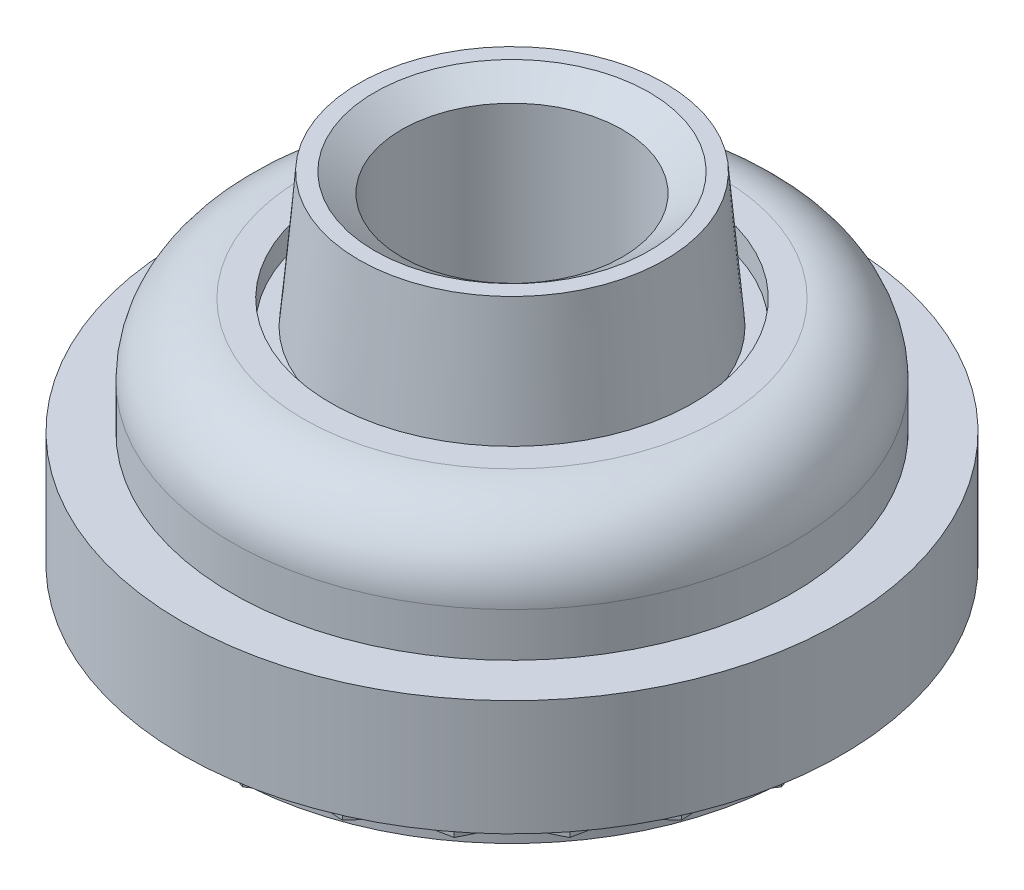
SolidWorks part; units mm, degrees
ref_plane "Plane1" through (0, 0, 0) normal (0, 0, 1) x (1, 0, 0)
ref_plane "Plane2" through (0, 0, 0) normal (0, 1, 0) x (1, 0, 0)
ref_plane "Plane3" through (0, 0, 0) normal (1, 0, 0) x (0, 0, -1)
sketch "BodySke" plane through (0, 0, 0) normal (0, 0, 1) x (1, 0, 0)
  line L0 (6.3049, 0) -> (7.62, 0)
  line L1 (7.62, 0) -> (7.62, 2.667)
  line L2 (3.5389, 7.874) -> (2.5527, 7.874)
  line L3 (2.5527, 7.874) -> (2.5527, -0.9652)
  line L4 (2.5527, -0.9652) -> (6.5278, -0.9652)
  line L5 (6.5278, -0.9652) -> (6.5278, -0.7722)
  line L6 (6.5278, -0.7722) -> (6.3049, -0.3861)
  line L7 (1.016, 1.27) -> (3.6522, 1.27) construction
  line L9 (0, 0) -> (0, 15.24) construction
  line L10 (6.3049, -0.3861) -> (6.3049, 0)
  line L11 (3.81, 4.7752) -> (4.191, 4.7752)
  line L12 (4.191, 4.7752) -> (4.191, 5.334)
  line L13 (4.191, 5.334) -> (4.826, 5.334)
  line L14 (7.62, 2.667) -> (6.477, 2.667)
  line L15 (6.477, 2.667) -> (6.477, 3.683)
  line L16 (3.81, 4.7752) -> (3.5389, 7.874)
  arc A0 (6.477, 3.683) -> (4.826, 5.334) centre (4.826, 3.683) ccw
  dimension "D1" = 60
  dimension "E_dia" = 15.24
  dimension "C_dia" = 13.0556
  dimension "A_ht" = 0.9652
  dimension "Thread_min" = 5.1054
  dimension "C_len" = 0.193
  dimension "Clinching_ht" = 0.3861
  dimension "Advance" = 1.27
  dimension "T2_ht" = 7.874
  dimension "Nose_dia" = 7.62
  dimension "Guide_dia" = 8.382
  dimension "Top_flat_wid" = 0.635
  dimension "T1_ht" = 5.334
  dimension "T2_nl_lim" = 4.7752
  dimension "D_dia" = 12.954
  dimension "Shoulder_ht" = 2.667
  dimension "Nose_ang" = 175
revolve "Body" add sketch "BodySke"
revolve "EndChamfer" cut sketch "EndChamferSke" angle 360 about L0
sketch "EndChamferSke" plane through (0, 0, 0) normal (0, 0, 1) x (1, 0, 0)
  line L0 (0, -2.54) -> (0, 7.62) construction
  line L1 (0, 0) -> (0, 15.24) construction
  line L2 (3.175, -1.2192) -> (3.175, -0.9627)
  line L3 (3.175, -0.9627) -> (2.5527, -0.5271)
  line L4 (2.5527, -0.5271) -> (2.5527, -1.2192)
  line L5 (2.5527, -1.2192) -> (3.175, -1.2192)
  line L6 (3.175, 7.874) -> (2.5527, 7.4384)
  line L8 (2.5527, 7.4384) -> (2.5527, 7.874)
  line L9 (3.175, 7.874) -> (2.5527, 7.874)
  line L10 (2.5527, 7.874) -> (-2.5527, 7.874) construction
  line L11 (-6.5278, -0.9652) -> (6.5278, -0.9652) construction
  dimension "D1" = 0.254
  dimension "Thread_nominal" = 6.35
  dimension "D2" = 34.99
  dimension "Thread_min" = 5.1054
  dimension "Inset" = 0.0025
sketch "CliRinSegSke" plane through (0, 0, 0) normal (0, -1, 0) x (1, 0, 0)
  line L0 (0, 0) -> (0, 7.62) construction
  line L1 (0.9449, 7.1771) -> (0, 6.858)
  line L2 (0, 6.858) -> (-0.9449, 7.1771)
  line L3 (-0.9449, 7.1771) -> (-0.9165, 6.9618)
  line L4 (-0.9165, 6.9618) -> (0, 6.6523)
  line L5 (0, 6.6523) -> (0.9165, 6.9618)
  line L6 (0.9165, 6.9618) -> (0.9449, 7.1771)
  circle A0 centre (0, 0) radius 7.239 construction
  circle A1 centre (0, 0) radius 6.858 construction
  circle A2 centre (0, 0) radius 6.6523 construction
  circle A3 centre (0, 0) radius 7.0218 construction
  circle A4 centre (0, 0) radius 6.5278 construction
  dimension "D2" = 14.0437
  dimension "D3" = 13.716
  dimension "D4" = 13.3045
  dimension "D1" = 14.478
  dimension "Angle" = 15
ref_plane "Plane4" through (0, -0.5486, 0) normal (0, 1, 0) x (-1, 0, 0)
sketch "ThdSchSke" plane through (0, 0, 0) normal (0, 0, 1) x (1, 0, 0)
  line L0 (0, -5.08) -> (0, 7.62) construction
  line L1 (0, 0) -> (0, 15.24) construction
  line L2 (0, -0.9627) -> (3.175, -0.9627) construction
  line L4 (3.175, -0.9627) -> (2.5527, -0.5269)
  line L6 (3.175, -0.9627) -> (2.5527, -1.3984)
  line L7 (2.5527, -0.5269) -> (2.5527, -1.3984)
  line L8 (3.175, -0.9627) -> (-3.175, -0.9627) construction
  dimension "Vee_angle" = 70
  dimension "Thread_nominal" = 6.35
  dimension "Thread_min" = 5.1054
revolve "ThreadSchematic" [suppressed] cut sketch "ThdSchSke" angle 360 about L0
pattern_linear "ThdSchPat" [suppressed]
extrude "ClinchingRingSegment" add sketch "CliRinSegSke" along normal blind 0.3861
pattern_circular "ClinchingRing" count 24 every 15 about axis through (0, 0, 0) along (0, 1, 0) of "ClinchingRingSegment"
sketch "SqrCutSke" plane through (0, -0.9652, 0) normal (0, -1, 0) x (1, 0, 0)
  line L0 (3.81, -3.556) -> (3.81, 3.556)
  line L1 (3.556, 3.81) -> (-3.556, 3.81)
  line L2 (-3.81, 3.556) -> (-3.81, -3.556)
  line L3 (-3.556, -3.81) -> (3.556, -3.81)
  line L4 (-3.556, -4.191) -> (3.556, -4.191)
  line L5 (-4.191, 3.556) -> (-4.191, -3.556)
  line L6 (3.556, 4.191) -> (-3.556, 4.191)
  line L7 (4.191, -3.556) -> (4.191, 3.556)
  circle A0 centre (0, 0) radius 3.81 construction
  circle A1 centre (0, 0) radius 3.81 construction
  circle A4 centre (0, 0) radius 5.3882 construction
  arc A6 (-3.81, 3.556) -> (-3.556, 3.81) centre (-3.556, 3.556) cw
  arc A7 (3.81, 3.556) -> (3.556, 3.81) centre (3.556, 3.556) ccw
  arc A8 (3.556, -3.81) -> (3.81, -3.556) centre (3.556, -3.556) ccw
  arc A9 (-3.81, -3.556) -> (-3.556, -3.81) centre (-3.556, -3.556) ccw
  arc A10 (-4.191, -3.556) -> (-3.556, -4.191) centre (-3.556, -3.556) ccw
  arc A11 (-4.191, 3.556) -> (-3.556, 4.191) centre (-3.556, 3.556) cw
  arc A12 (4.191, 3.556) -> (3.556, 4.191) centre (3.556, 3.556) ccw
  arc A13 (3.556, -4.191) -> (4.191, -3.556) centre (3.556, -3.556) ccw
  point P12 (-3.81, 3.81)
  point P15 (3.81, 3.81)
  point P18 (3.81, -3.81)
  point P21 (-3.81, -3.81)
  dimension "D1" = 0.254
  dimension "D2" = 0.381
extrude "SqrCut" cut sketch "SqrCutSke" against normal blind 0.9652
equation "' \"A_ht@BodySke\" = 0.038"
equation "' \"C_dia@BodySke\" = 0.514"
equation "' \"D_dia@BodySke\" = 0.51"
equation "' \"E_dia@BodySke\" = 0.6"
equation "' \"T1_ht@BodySke\" = 0.21"
equation "' \"T2_ht@BodySke\" = 0.31"
equation "' \"Advance@BodySke\" = 0.05"
equation "' \"Thread_min@BodySke\" = 0.201"
equation "' \"Thread_nominal@ThreadCosmetic\" = 0.25"
equation "' \"Nose_ang@BodySke\" = 175"
equation "' \"T2_ht@BodySke\" =  \"T1_ht@BodySke\" * 0.9 ' make NL"
equation "\"Nose_dia@BodySke\" = \"Thread_nominal@ThreadCosmetic\" * 1.2"
equation "\"Top_flat_wid@BodySke\" = \"Thread_nominal@ThreadCosmetic\" * 0.1"
equation "\"Guide_dia@BodySke\" = \"Nose_dia@BodySke\" + 0.03"
equation "\"T2_nl_lim@BodySke\" = \"T1_ht@BodySke\" * 0.9 - 0.001"
equation "\"Shoulder_ht@BodySke\" = \"T1_ht@BodySke\" * 0.5"
equation "\"Depth@SqrCut\" = \"A_ht@BodySke\""
equation "\"Count@ClinchingRing\" = 24"
equation "\"Angle@ClinchingRing\" = 360 / \"Count@ClinchingRing\""
equation "\"Angle@CliRinSegSke\" = 360 / \"Count@ClinchingRing\""
equation "\"D1@CliRinSegSke\" = \"E_dia@BodySke\" * 0.95"
equation "\"D2@CliRinSegSke\" = \"D1@CliRinSegSke\" * 0.97"
equation "\"D3@CliRinSegSke\" = \"E_dia@BodySke\" * 0.9"
equation "\"D4@CliRinSegSke\" = \"D3@CliRinSegSke\" * 0.97"
equation "\"C_len@BodySke\" = \"A_ht@BodySke\" * 0.2"
equation "\"Clinching_ht@BodySke\" = \"A_ht@BodySke\" * 0.4"
equation "\"Clinching_ht@ClinchingRingSegment\" =  \"A_ht@BodySke\" * 0.4"
equation "\"Thread_nominal@EndChamferSke\" = \"Thread_nominal@ThreadCosmetic\""
equation "\"Thread_min@EndChamferSke\" = \"Thread_min@BodySke\""
equation "\"D2@EndChamferSke\" = \"Vee_angle@ThdSchSke\" / 2 - 0.01"
equation "\"Thread_nominal@ThdSchSke\" = \"Thread_nominal@ThreadCosmetic\""
equation "\"Thread_min@ThdSchSke\" = \"Thread_min@BodySke\""
equation "\"Num_threads@ThdSchPat\" = int(  ( \"A_ht@BodySke\" + \"T2_ht@BodySke\" - \"Inset@EndChamferSke\" ) / \"Advance@BodySke\" + 0.999 )  + 1"
equation "\"Advance@ThdSchPat\" = (  \"A_ht@BodySke\" + \"T2_ht@BodySke\" - \"Inset@EndChamferSke\"  ) /  (\"Num_threads@ThdSchPat\" - 1) 'relax it"
